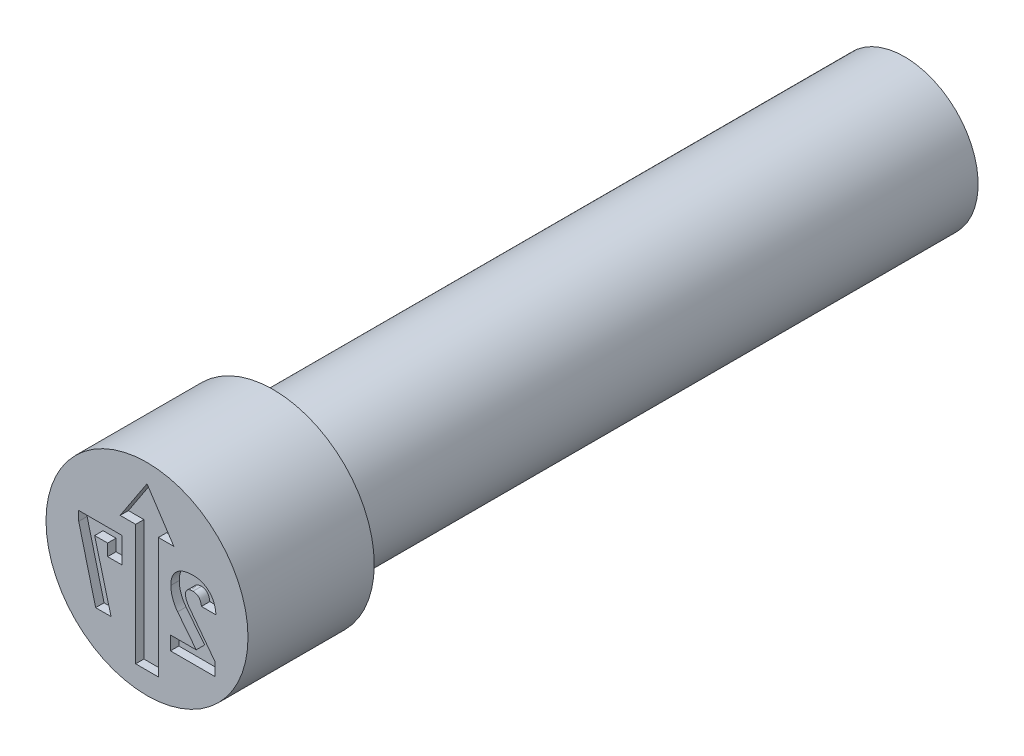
SolidWorks part; units mm, degrees
ref_plane "Front Plane" through (0, 0, 0) normal (0, 0, 1) x (1, 0, 0)
ref_plane "Top Plane" through (0, 0, 0) normal (0, 1, 0) x (1, 0, 0)
ref_plane "Right Plane" through (0, 0, 0) normal (1, 0, 0) x (0, 0, -1)
imported_body "Imported1"
sketch "Sketch1" plane through (0, 0, -0.4267) normal (0, 0, 1) x (1, 0, 0)
  line L7 (0.6385, 0.9906) -> (0, 1.9597)
  line L8 (0, 1.9597) -> (-0.6385, 0.9906)
  line L9 (-0.6385, 0.9906) -> (-0.27, 0.9906)
  line L10 (-0.27, 0.9906) -> (-0.27, -1.88)
  line L11 (-0.27, -1.88) -> (0.27, -1.88)
  line L12 (0.27, -1.88) -> (0.27, 0.9906)
  line L13 (0.27, 0.9906) -> (0.6385, 0.9906)
  line L14 (0.6385, 0.9906) -> (0, 1.9597)
  line L15 (0, 1.9597) -> (-0.6385, 0.9906)
  line L16 (-0.6385, 0.9906) -> (-0.27, 0.9906)
  line L17 (-0.27, 0.9906) -> (-0.27, -1.88)
  line L18 (-0.27, -1.88) -> (0.27, -1.88)
  line L19 (0.27, -1.88) -> (0.27, 0.9906)
  line L20 (0.27, 0.9906) -> (0.6385, 0.9906)
  dimension "D1" = 0
extrude "Boss-Extrude1" add sketch "Sketch1" along normal blind 0.23
sketch "Sketch2" plane through (0, 0, 0) normal (0, 0, 1) x (1, 0, 0)
  text T0 "2  7" font "Bahnschrift" height 1.8
  dimension "D1" = 1.75
  dimension "D2" = 1.2
extrude "Cut-Extrude1" cut sketch "Sketch2" against normal blind 0.2
